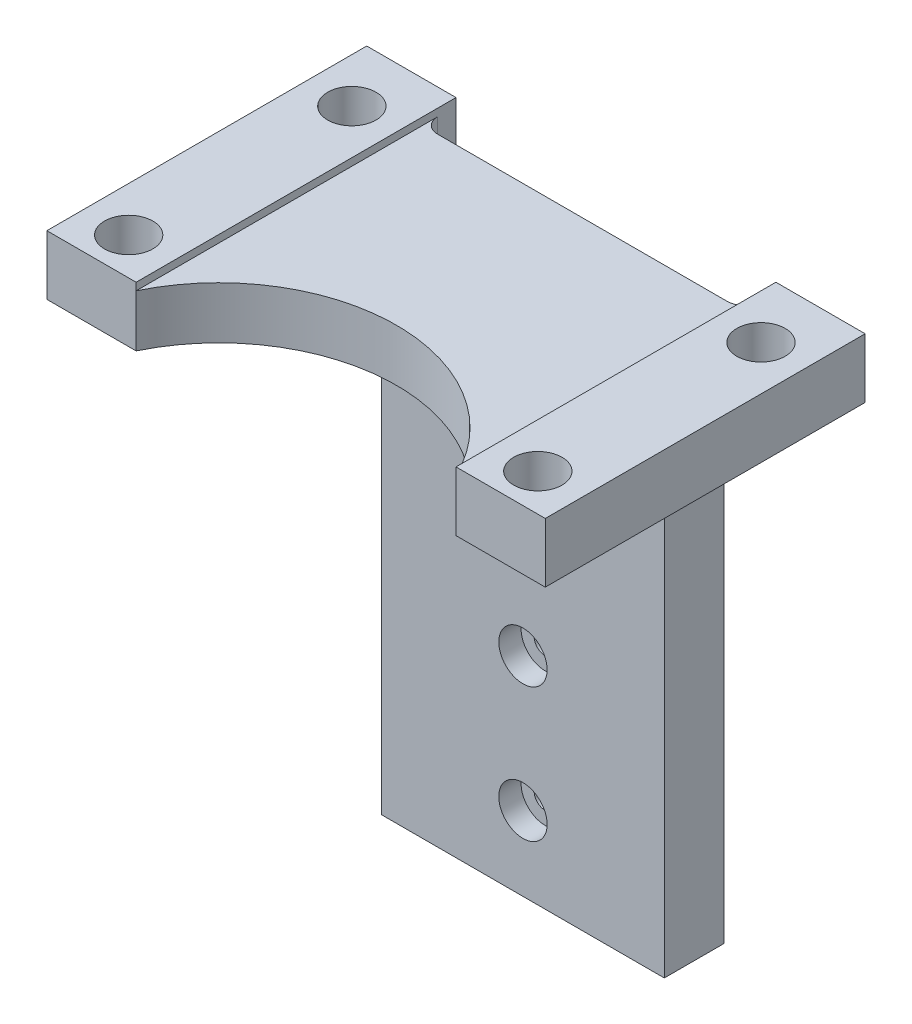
SolidWorks part; units mm, degrees
ref_plane "Plan de face" through (0, 0, 0) normal (0, 0, 1) x (1, 0, 0)
ref_plane "Plan de dessus" through (0, 0, 0) normal (0, 1, 0) x (1, 0, 0)
ref_plane "Plan de droite" through (0, 0, 0) normal (1, 0, 0) x (0, 0, -1)
sketch "Esquisse1" plane through (0, 0, 0) normal (0, 1, 0) x (1, 0, 0)
  line L0 (12, 43) -> (12, 40.5)
  line L1 (0, 0) -> (12, 0)
  line L2 (0, 0) -> (0, 43)
  line L3 (55, 43) -> (67, 43)
  line L4 (67, 0) -> (67, 43)
  line L6 (-9.6723, 13.5) -> (82.5602, 13.5) construction
  line L7 (0, 43) -> (12, 43)
  line L8 (55, 0) -> (67, 0)
  line L9 (14, 38.5) -> (53, 38.5)
  line L11 (55, 40.5) -> (55, 43)
  line L14 (61, 0) -> (61, 43) construction
  line L15 (6, 0) -> (6, 43) construction
  arc A0 (12, 0) -> (55, 0) centre (33.5, -10.3704) cw
  arc A1 (12, 40.5) -> (14, 38.5) centre (14, 40.5) ccw
  arc A2 (53, 38.5) -> (55, 40.5) centre (53, 40.5) ccw
  circle A3 centre (61, 5) radius 3.25
  circle A4 centre (61, 35) radius 3.25
  circle A5 centre (6, 5) radius 3.25
  circle A6 centre (6, 35) radius 3.25
  point P19 (12, 38.5)
  point P22 (55, 38.5)
  dimension "D5" = 2
  dimension "D6" = 5
  dimension "D7" = 8
  dimension "D1" = 67
  dimension "D2" = 43
extrude "Extrusion1" add sketch "Esquisse1" along normal blind 8
sketch "Esquisse2" plane through (0, 0, 0) normal (0, -1, 0) x (1, 0, 0)
  line L1 (52.5, -38.5) -> (14.5, -38.5)
  line L2 (52.5, -38.5) -> (52.5, -30.5)
  line L3 (52.5, -30.5) -> (14.5, -30.5)
  line L4 (14.5, -38.5) -> (14.5, -30.5)
  line L6 (0, -43) -> (0, 0) construction
  dimension "D1" = 38
  dimension "D2" = 8
  dimension "D3" = 14.5
extrude "Extrusion2" add sketch "Esquisse2" along normal blind 68
sketch "Esquisse3" plane through (0, 0, -30.5) normal (0, 0, 1) x (1, 0, 0)
  line L0 (33.5, -68) -> (33.5, -6.4231) construction
  line L1 (52.5, -68) -> (14.5, -68) construction
  circle A0 centre (33.5, -58) radius 3.25
  circle A1 centre (33.5, -40) radius 3.25
  circle A2 centre (33.5, -22) radius 3.25
  dimension "D1" = 6.5
  dimension "D2" = 10
extrude "Enlèv. mat.-Extru.1" cut sketch "Esquisse3" against normal blind 3
sketch "Esquisse4" plane through (0, 0, -33.5) normal (0, 0, 1) x (1, 0, 0)
  circle A0 centre (33.5, -58) radius 1.5
  circle A1 centre (33.5, -40) radius 1.5
  circle A2 centre (33.5, -22) radius 1.5
extrude "Enlèv. mat.-Extru.2" cut sketch "Esquisse4" against normal through all
sketch "Esquisse5" plane through (0, 8, 0) normal (0, 1, 0) x (-1, 0, 0)
  line L1 (-55, -43) -> (-12, -43)
  line L2 (-55, -43) -> (-55, 0)
  line L3 (-55, 0) -> (-12, 0)
  line L4 (-12, -43) -> (-12, 0)
extrude "Enlèv. mat.-Extru.3" cut sketch "Esquisse5" against normal blind 1
